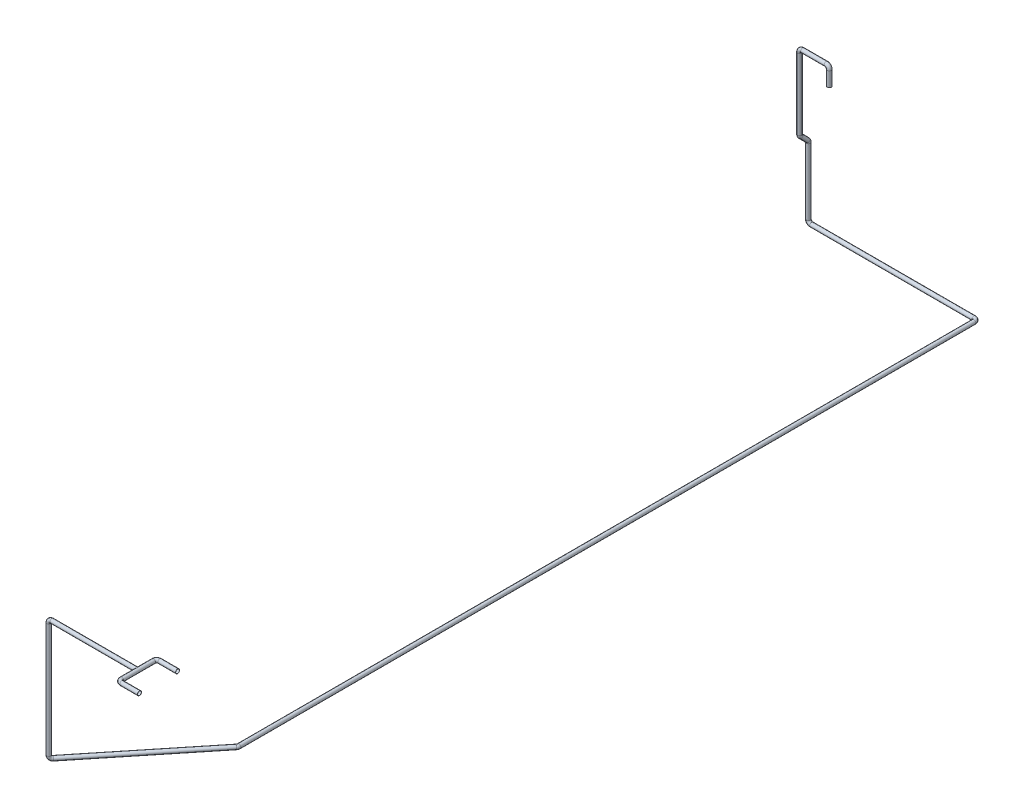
SolidWorks part; units mm, degrees
ref_plane "Alzado" through (0, 0, 0) normal (0, 0, 1) x (1, 0, 0)
ref_plane "Planta" through (0, 0, 0) normal (0, 1, 0) x (1, 0, 0)
ref_plane "Vista lateral" through (0, 0, 0) normal (1, 0, 0) x (0, 0, -1)
sketch3d "Croquis3D1"
  line L0 (0, 0, 0) -> (0, 230, 0)
  line L1 (-50, 280, 0) -> (-420, 280, 0)
  line L2 (-470, 230, 0) -> (-470, -889.2893, 0)
  line L3 (-470, -924.6447, -14.6447) -> (-470, -1035.3553, -125.3553)
  line L4 (-470, -1070.7107, -140) -> (-470, -2120, -140)
  line L5 (-420, -2170, -140) -> (2140, -2170, -140)
  line L6 (2190, -2170, -90) -> (2190, -2170, 11502.3432)
  line L7 (-470, -1035.3553, -125.3553) -> (-470, -1035.3553, 1491.7931) construction
  line L8 (-420, 280, 0) -> (-420, 280, 517.6845) construction
  line L9 (2178.9122, -2170, 11533.7413) -> (891.3982, -2170, 13129.3749)
  line L11 (860, -2170, 13168.2871) -> (860, -2170, 12912.7484) construction
  line L12 (860, -2120, 13168.2871) -> (860, -314, 13168.2871)
  line L13 (910, -264, 13168.2871) -> (2260, -264, 13168.2871)
  arc A0 (860, -314, 13168.2871) -> (910, -264, 13168.2871) centre (910, -314, 13168.2871) ccw
  arc A1 (-470, -2120, -140) -> (-420, -2170, -140) centre (-420, -2120, -140) ccw
  arc A2 (-470, -1035.3553, -125.3553) -> (-470, -1070.7107, -140) centre (-470, -1070.7107, -90) ccw
  arc A3 (-470, -889.2893, 0) -> (-470, -924.6447, -14.6447) centre (-470, -889.2893, -50) ccw
  arc A4 (-420, 280, 0) -> (-470, 230, 0) centre (-420, 230, 0) ccw
  arc A5 (0, 230, 0) -> (-50, 280, 0) centre (-50, 230, 0) ccw
  arc A6 (891.3982, -2170, 13129.3749) -> (860, -2120, 13168.2871) centre (891.3982, -2120, 13129.3749) ccw
  arc A7 (2190, -2170, 11502.3432) -> (2178.9122, -2170, 11533.7413) centre (2140, -2170, 11502.3432) ccw
  arc A8 (2140, -2170, -140) -> (2190, -2170, -90) centre (2140, -2170, -90) ccw
  point P15 (-470, -2170, -140)
  point P16 (-420, -2120, -90)
  point P19 (-470, -1050, -140)
  point P20 (-520, -1070.7107, -90)
  point P23 (-470, -910, 0)
  point P24 (-420, -889.2893, -50)
  point P27 (-470, 280, 0)
  point P28 (-420, 230, 50)
  point P31 (0, 280, 0)
  point P32 (-50, 230, 50)
  point P42 (860, -264, 13168.2871)
  point P43 (910, -314, 13118.2871)
  point P46 (860, -2170, 13168.2871)
  point P48 (852.486, -2120, 13097.9768)
  point P51 (2190, -2170, 11520)
  point P52 (2140, -2220, 11502.3432)
  point P55 (2190, -2170, -140)
  point P57 (2140, -2220, -90)
  dimension "D1" = 280
  dimension "D9" = 11660
  dimension "D10" = 1316.3053
  dimension "D12" = 1330
  dimension "D11" = 141.1
  dimension "D13" = 1906
  dimension "D8" = 70.7107
  dimension "D15" = 50
  dimension "D22" = 50
  dimension "D2" = 470
  dimension "D3" = 1190
  dimension "D4" = 140
  dimension "D5" = 225
  dimension "D6" = 1120
  dimension "D7" = 2660
  dimension "D14" = 1400
sketch "Croquis2" plane through (0, 0, 0) normal (0, 1, 0) x (1, 0, 0)
  circle A0 centre (0, 0) radius 31.75
  circle A1 centre (0, 0) radius 30.5
  dimension "D1" = 61
  dimension "D2" = 63.5
sweep "Barrer1" add profiles "Croquis2" path "Croquis3D1"
sketch3d "Croquis3D2"
  line L0 (2260, -264, 13168.2871) -> (2260, -264, 12917.7871)
  line L1 (2260, -264, 13168.2871) -> (2260, -264, 13418.7871)
  line L2 (2310, -264, 13468.7871) -> (2590, -264, 13468.7871)
  line L3 (2310, -264, 12867.7871) -> (2590, -264, 12867.7871)
  arc A0 (2260, -264, 13418.7871) -> (2310, -264, 13468.7871) centre (2310, -264, 13418.7871) ccw
  arc A1 (2260, -264, 12917.7871) -> (2310, -264, 12867.7871) centre (2310, -264, 12917.7871) ccw
  point P8 (2260, -264, 13468.7871)
  point P9 (2310, -214, 13418.7871)
  point P12 (2260, -264, 12867.7871)
  point P13 (2310, -314, 12917.7871)
  dimension "D5" = 50
  dimension "D1" = 300.5
  dimension "D2" = 300.5
  dimension "D3" = 330
  dimension "D4" = 330
ref_plane "Plano4" through (2590, -264, 13468.7871) normal (1, 0, 0) x (0, 0, -1)
sketch "Croquis5" plane through (2590, -264, 13468.7871) normal (1, 0, 0) x (0, 0, -1)
  circle A0 centre (0, 0) radius 31.75
  circle A1 centre (0, 0) radius 30
  dimension "D1" = 60
  dimension "D2" = 63.5
sweep "Barrer4" add profiles "Croquis5" path "Croquis3D2"
